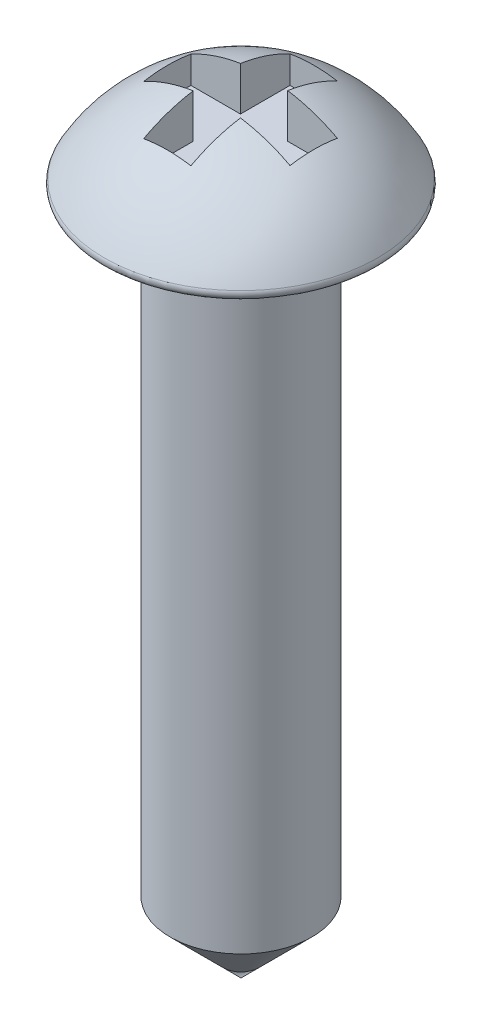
SolidWorks part; units mm, degrees
ref_plane "Plan de face" through (0, 0, 0) normal (0, 0, 1) x (1, 0, 0)
ref_plane "Plan de dessus" through (0, 0, 0) normal (0, 1, 0) x (1, 0, 0)
ref_plane "Plan de droite" through (0, 0, 0) normal (1, 0, 0) x (0, 0, -1)
sketch "Esquisse1" plane through (0, 0, 0) normal (0, 0, 1) x (1, 0, 0)
  line L0 (0, 3.8001) -> (0, -10.6) construction
  line L1 (2.2, 0) -> (1.1, 0)
  line L2 (1.1, 0) -> (1.1, -9.5)
  line L3 (1.1, -9.5) -> (0, -10.6)
  line L4 (0, -10.6) -> (0, 1.393)
  arc A0 (2.2, 0) -> (0, 1.393) centre (0, -1.0408) ccw
  dimension "D4" = 135
  dimension "D1" = 1.1
  dimension "D2" = 9.5
  dimension "D3" = 2.2
revolve "Révolution1" add sketch "Esquisse1" angle 360 about L0
fillet "Congé1" radius 0.1 1 edges at (-2.2, 0, 0)
ref_plane "Plan1" through (0, 1.1565, 0) normal (0, 1, 0) x (-1, 0, 0)
sketch "Esquisse2" plane through (0, 1.1565, 0) normal (0, 1, 0) x (-1, 0, 0)
  line L0 (0.0048, 1.1408) -> (0.0048, 0.0036) construction
  line L1 (-0.3619, 1.1408) -> (0.3716, 1.1408)
  line L2 (-0.3619, 1.1408) -> (-0.3619, 0.3704)
  line L3 (-0.3619, -1.1335) -> (0.3716, -1.1335)
  line L4 (0.3716, 1.1408) -> (0.3716, 0.3704)
  line L5 (-1.1323, 0.3704) -> (-0.3619, 0.3704)
  line L6 (-1.1323, 0.3704) -> (-1.1323, -0.3632)
  line L7 (-1.1323, -0.3632) -> (-0.3619, -0.3632)
  line L8 (1.142, 0.3704) -> (1.142, -0.3632)
  line L9 (0.0048, 0.0036) -> (0.0048, -1.1335) construction
  line L10 (1.142, 0.0036) -> (0.0048, 0.0036) construction
  line L11 (0.0048, 0.0036) -> (-1.1323, 0.0036) construction
  line L12 (0.3716, -0.3632) -> (1.142, -0.3632)
  line L13 (-0.3619, -0.3632) -> (-0.3619, -1.1335)
  line L14 (0.3716, 0.3704) -> (1.142, 0.3704)
  line L15 (0.3716, -0.3632) -> (0.3716, -1.1335)
extrude "Enlèv. mat.-Extru.1" cut sketch "Esquisse2" against normal mid plane 1
